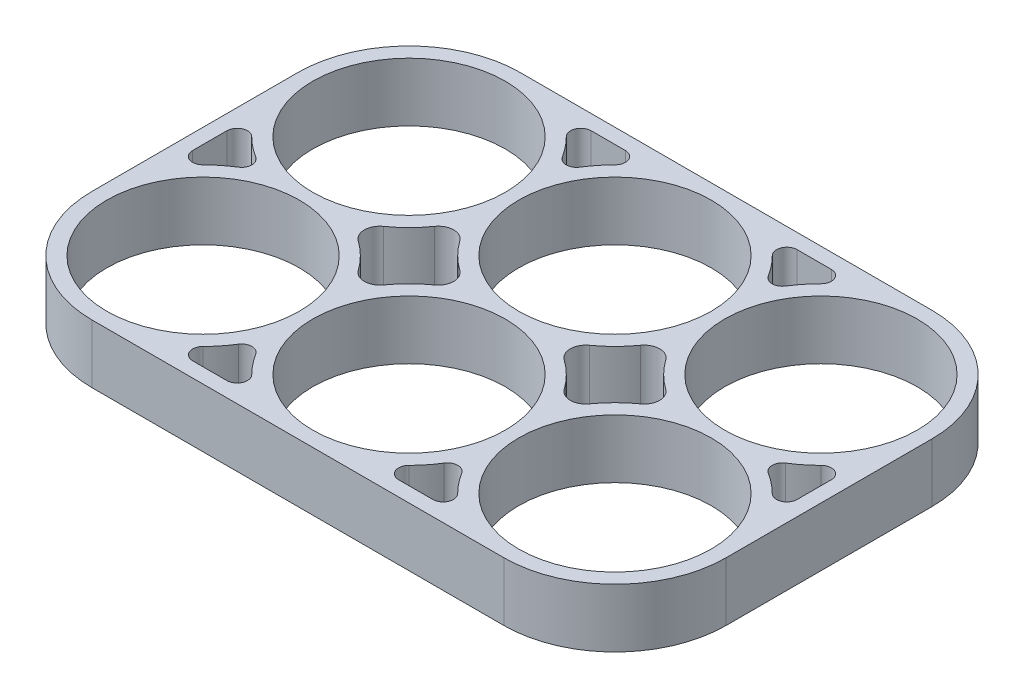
SolidWorks part; units mm, degrees
ref_plane "Ebene vorne" through (0, 0, 0) normal (0, 0, 1) x (1, 0, 0)
ref_plane "Ebene oben" through (0, 0, 0) normal (0, 1, 0) x (1, 0, 0)
ref_plane "Ebene rechts" through (0, 0, 0) normal (1, 0, 0) x (0, 0, -1)
sketch "Skizze1" plane through (0, 0, 0) normal (0, 1, 0) x (1, 0, 0)
  line L0 (0, -50) -> (0, 50) construction
  line L2 (-50, 0) -> (50, 0) construction
  line L4 (-30.8, 10) -> (-30.8, -10)
  line L5 (-29.35, 1.6623) -> (-29.35, -1.6623)
  line L6 (-20, -20.8) -> (20, -20.8)
  line L7 (-11.6623, -19.35) -> (-8.3377, -19.35)
  line L8 (8.3377, -19.35) -> (11.6623, -19.35)
  line L9 (30.8, 10) -> (30.8, -10)
  line L10 (29.35, 1.6623) -> (29.35, -1.6623)
  line L11 (-20, 20.8) -> (20, 20.8)
  line L12 (-11.6623, 19.35) -> (-8.3377, 19.35)
  line L13 (8.3377, 19.35) -> (11.6623, 19.35)
  circle A0 centre (-20, -10) radius 9.35
  circle A1 centre (0, -10) radius 9.35
  circle A2 centre (20, -10) radius 9.35
  circle A3 centre (20, 10) radius 9.35
  circle A4 centre (0, 10) radius 9.35
  circle A5 centre (-20, 10) radius 9.35
  arc A6 (-13.7117, 1.2195) -> (-11.2195, 3.7117) centre (-20, 10) ccw
  arc A7 (6.2883, 1.2195) -> (8.7805, 3.7117) centre (0, 10) ccw
  arc A9 (13.7117, -1.2195) -> (11.2195, -3.7117) centre (20, -10) ccw
  arc A10 (-6.2883, -1.2195) -> (-8.7805, -3.7117) centre (0, -10) ccw
  arc A11 (-25.7333, -0.8475) -> (-27.6424, -2.3689) centre (-20, -10) ccw
  arc A12 (25.7333, 0.8475) -> (27.6424, 2.3689) centre (20, 10) ccw
  arc A13 (8.7805, -3.7117) -> (6.2883, -1.2195) centre (0, -10) ccw
  arc A14 (10.8475, -15.7333) -> (12.3689, -17.6424) centre (20, -10) ccw
  arc A15 (-11.2195, -3.7117) -> (-13.7117, -1.2195) centre (-20, -10) ccw
  arc A16 (-9.1525, -15.7333) -> (-7.6311, -17.6424) centre (0, -10) ccw
  arc A17 (-10.8475, 15.7333) -> (-12.3689, 17.6424) centre (-20, 10) ccw
  arc A18 (-8.7805, 3.7117) -> (-6.2883, 1.2195) centre (0, 10) ccw
  arc A19 (9.1525, 15.7333) -> (7.6311, 17.6424) centre (0, 10) ccw
  arc A20 (11.2195, 3.7117) -> (13.7117, 1.2195) centre (20, 10) ccw
  arc A21 (-30.8, -10) -> (-20, -20.8) centre (-20, -10) ccw
  arc A22 (-27.6424, 2.3689) -> (-25.7333, 0.8475) centre (-20, 10) ccw
  arc A23 (-12.3689, -17.6424) -> (-10.8475, -15.7333) centre (-20, -10) ccw
  arc A24 (7.6311, -17.6424) -> (9.1525, -15.7333) centre (0, -10) ccw
  arc A25 (20, -20.8) -> (30.8, -10) centre (20, -10) ccw
  arc A26 (30.8, 10) -> (20, 20.8) centre (20, 10) ccw
  arc A27 (27.6424, -2.3689) -> (25.7333, -0.8475) centre (20, -10) ccw
  arc A28 (-20, 20.8) -> (-30.8, 10) centre (-20, 10) ccw
  arc A29 (-7.6311, 17.6424) -> (-9.1525, 15.7333) centre (0, 10) ccw
  arc A30 (12.3689, 17.6424) -> (10.8475, 15.7333) centre (20, 10) ccw
  arc A31 (25.7333, -0.8475) -> (25.7333, 0.8475) centre (26.2642, 0) cw
  arc A32 (27.6424, -2.3689) -> (29.35, -1.6623) centre (28.35, -1.6623) ccw
  arc A33 (29.35, 1.6623) -> (27.6424, 2.3689) centre (28.35, 1.6623) ccw
  arc A34 (-29.35, 1.6623) -> (-27.6424, 2.3689) centre (-28.35, 1.6623) cw
  arc A35 (-27.6424, -2.3689) -> (-29.35, -1.6623) centre (-28.35, -1.6623) cw
  arc A36 (-25.7333, -0.8475) -> (-25.7333, 0.8475) centre (-26.2642, 0) ccw
  arc A37 (-11.6623, -19.35) -> (-12.3689, -17.6424) centre (-11.6623, -18.35) cw
  arc A38 (-8.3377, -19.35) -> (-7.6311, -17.6424) centre (-8.3377, -18.35) ccw
  arc A39 (-9.1525, -15.7333) -> (-10.8475, -15.7333) centre (-10, -16.2642) ccw
  arc A40 (11.6623, -19.35) -> (12.3689, -17.6424) centre (11.6623, -18.35) ccw
  arc A41 (8.3377, -19.35) -> (7.6311, -17.6424) centre (8.3377, -18.35) cw
  arc A42 (9.1525, -15.7333) -> (10.8475, -15.7333) centre (10, -16.2642) cw
  arc A43 (9.1525, 15.7333) -> (10.8475, 15.7333) centre (10, 16.2642) ccw
  arc A44 (12.3689, 17.6424) -> (11.6623, 19.35) centre (11.6623, 18.35) ccw
  arc A45 (7.6311, 17.6424) -> (8.3377, 19.35) centre (8.3377, 18.35) cw
  arc A46 (-10.8475, 15.7333) -> (-9.1525, 15.7333) centre (-10, 16.2642) ccw
  arc A47 (-7.6311, 17.6424) -> (-8.3377, 19.35) centre (-8.3377, 18.35) ccw
  arc A48 (-11.6623, 19.35) -> (-12.3689, 17.6424) centre (-11.6623, 18.35) ccw
  arc A49 (6.2883, -1.2195) -> (6.2883, 1.2195) centre (7.1617, 0) cw
  arc A50 (8.7805, -3.7117) -> (11.2195, -3.7117) centre (10, -2.8383) ccw
  arc A51 (13.7117, -1.2195) -> (13.7117, 1.2195) centre (12.8383, 0) ccw
  arc A52 (11.2195, 3.7117) -> (8.7805, 3.7117) centre (10, 2.8383) ccw
  arc A53 (-13.7117, -1.2195) -> (-13.7117, 1.2195) centre (-12.8383, 0) cw
  arc A54 (-11.2195, -3.7117) -> (-8.7805, -3.7117) centre (-10, -2.8383) ccw
  arc A55 (-6.2883, -1.2195) -> (-6.2883, 1.2195) centre (-7.1617, 0) ccw
  arc A56 (-8.7805, 3.7117) -> (-11.2195, 3.7117) centre (-10, 2.8383) ccw
  point P58 (-29.35, 4.5947)
  point P65 (-14.5947, -19.35)
  point P98 (-15.9208, 0)
  dimension "D1" = 18.7
  dimension "D2" = 21.6
  dimension "D6" = 1
  dimension "2" = 1.5
  dimension "D3" = 20
  dimension "D4" = 20
  dimension "D5" = 20
extrude "Aufsatz-Linear austragen1" add sketch "Skizze1" along normal blind 5.7
